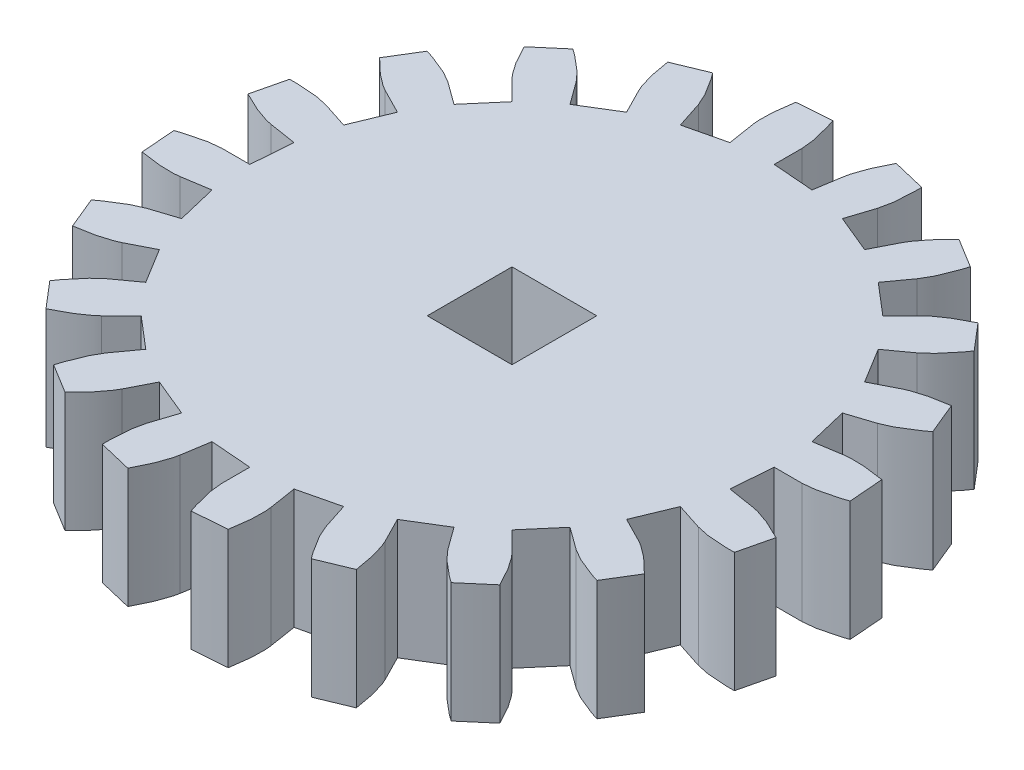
SolidWorks part; units mm, degrees
ref_plane "Front Plane" through (0, 0, 0) normal (0, 0, 1) x (1, 0, 0)
ref_plane "Top Plane" through (0, 0, 0) normal (0, 1, 0) x (1, 0, 0)
ref_plane "Right Plane" through (0, 0, 0) normal (1, 0, 0) x (0, 0, -1)
sketch "Sketch1" plane through (0, 0, 0) normal (0, 1, 0) x (1, 0, 0)
  line L0 (0, 0) -> (0, 2.4204) construction
  line L1 (0, 0) -> (-2.4204, 0) construction
  line L2 (0, 0) -> (-2.7415, -0.2158) construction
  line L3 (0, 0) -> (-2.3906, -0.3786) construction
  line L4 (0, 0) -> (-2.3019, -0.7479) construction
  circle A0 centre (0, 0) radius 2.5 construction
  circle A1 centre (0, 0) radius 2.4204 construction
  circle A2 centre (0, 0) radius 2.1875 construction
  circle A3 centre (0, 0) radius 2.75 construction
  spline S0 degree 4 poles (-2.4204, 0) (-2.4292, 0) (-2.454, -0.0009) (-2.5006, -0.0062) (-2.5759, -0.0199) (-2.6705, -0.0447) (-2.7905, -0.0851) (-2.9283, -0.143) (-3.0753, -0.2174) (-3.2297, -0.3094) (-3.3783, -0.4109) (-3.5209, -0.5204) (-3.6576, -0.6373) (-3.8165, -0.7868) (-3.9972, -0.9784) (-4.193, -1.2163) (-4.3961, -1.5059) (-4.5811, -1.8139) (-4.7448, -2.1352) (-4.8878, -2.4639) (-5.0106, -2.8045) (-5.1135, -3.145) (-5.1975, -3.5021) (-5.254, -3.7998) (-5.292, -4.0848) (-5.3195, -4.3232) (-5.34, -4.636) (-5.3474, -4.8365) (-5.3483, -5.1432) (-5.3425, -5.2576) (-5.3397, -5.3468) knots 0 0 0 0 0 0.005377 0.015084 0.028532 0.04661 0.064855 0.092111 0.119476 0.146842 0.174209 0.201575 0.228941 0.256307 0.307035 0.361767 0.4165 0.471232 0.525964 0.580697 0.635429 0.690161 0.744894 0.799626 0.826992 0.854358 0.909091 0.954545 1 1 1 1 1 construction
  spline S1 degree 4 poles (-2.4204, 0) (-2.4292, 0) (-2.454, -0.0009) (-2.5006, -0.0062) (-2.5759, -0.0199) (-2.6705, -0.0447) (-2.7905, -0.0851) (-2.9283, -0.143) (-3.0753, -0.2174) (-3.2297, -0.3094) (-3.3783, -0.4109) (-3.5209, -0.5204) (-3.6576, -0.6373) (-3.8165, -0.7868) (-3.9972, -0.9784) (-4.193, -1.2163) (-4.3961, -1.5059) (-4.5811, -1.8139) (-4.7448, -2.1352) (-4.8878, -2.4639) (-5.0106, -2.8045) (-5.1135, -3.145) (-5.1975, -3.5021) (-5.254, -3.7998) (-5.292, -4.0848) (-5.3195, -4.3232) (-5.334, -4.5442) (-5.3401, -4.6645) (-5.3428, -4.7462) knots 0 0 0 0 0 0.005377 0.015084 0.028532 0.04661 0.064855 0.092111 0.119476 0.146842 0.174209 0.201575 0.228941 0.256307 0.307035 0.361767 0.4165 0.471232 0.525964 0.580697 0.635429 0.690161 0.744894 0.799626 0.826992 0.854358 0.909091 0.909091 0.909091 0.909091 0.909091
  dimension "D1" = 5.5
  dimension "D2" = 5
  dimension "D3" = 4.8407
  dimension "D4" = 4.375
  dimension "D5" = 2.4204
  dimension "D6" = 4.5
  dimension "D7" = 9
  dimension "D8" = 18
sketch "Sketch2" plane through (0, 0, 0) normal (0, 1, 0) x (1, 0, 0)
  line L0 (0, 0) -> (-2.7415, -0.2158) construction
  line L1 (0, 0) -> (-2.7415, -0.2158) construction
  line L2 (0, 0) -> (-2.3906, -0.3786) construction
  line L3 (0, 0) -> (-2.4204, 0) construction
  line L4 (0, 0) -> (-2.3019, -0.7479) construction
  line L5 (0, 0) -> (-2.3906, -0.3786) construction
  line L6 (0, 0) -> (-2.4204, 0) construction
  line L7 (0, 0) -> (-2.3019, -0.7479) construction
  line L8 (-2.3906, -0.3786) -> (-2.1606, -0.3422)
  line L9 (-2.1606, -0.3422) -> (-2.0804, -0.676)
  line L10 (-2.0804, -0.676) -> (-2.3019, -0.7479) construction
  line L11 (-2.0804, -0.676) -> (-0.4755, -0.1545)
  line L12 (-2.4204, 0) -> (-0.5, 0)
  circle A0 centre (0, 0) radius 2.1875 construction
  circle A1 centre (0, 0) radius 2.4204 construction
  circle A2 centre (0, 0) radius 2.5 construction
  circle A3 centre (0, 0) radius 2.75 construction
  circle A4 centre (0, 0) radius 2.1875 construction
  circle A5 centre (0, 0) radius 2.4204 construction
  circle A6 centre (0, 0) radius 2.5 construction
  circle A7 centre (0, 0) radius 2.75 construction
  arc A8 (-2.7265, -0.3589) -> (-2.7491, -0.0721) centre (0, 0) cw
  circle A11 centre (0, 0) radius 0.5 construction
  arc A12 (-0.5, 0) -> (-0.4755, -0.1545) centre (0, 0) ccw
  spline S0 degree 4 poles (-33.0679, -999.4945) (-0.9019, -19.3405) (-1.14, -0.3967) (-1.8935, 0.1042) (-2.5759, -0.0199) (-2.6705, -0.0447) (-2.7905, -0.0851) (-2.9283, -0.143) (-3.0753, -0.2174) (-3.2297, -0.3094) (-3.3783, -0.4109) (-3.5209, -0.5204) (-3.6576, -0.6373) (-3.8165, -0.7868) (-3.9972, -0.9784) (-4.193, -1.2163) (-4.3961, -1.5059) (-4.5811, -1.8139) (-4.7448, -2.1352) (-4.8878, -2.4639) (-5.0106, -2.8045) (-5.1135, -3.145) (-5.1975, -3.5021) (-5.254, -3.7998) (-5.292, -4.0848) (-5.4268, -5.2538) (-5.3728, -9.2591) (-3.3786, 39.0614) (-37.5486, -1004.1885) knots -0.375533 -0.375533 -0.375533 -0.375533 -0.375533 0.005377 0.015084 0.028532 0.04661 0.064855 0.092111 0.119476 0.146842 0.174209 0.201575 0.228941 0.256307 0.307035 0.361767 0.4165 0.471232 0.525964 0.580697 0.635429 0.690161 0.744894 0.799626 0.826992 0.854358 1.549923 1.549923 1.549923 1.549923 1.549923 only from (-2.4204, 0) to (-5.3428, -4.7462) construction
  spline S1 degree 4 poles (-2.4204, 0) (-2.4292, 0) (-2.454, -0.0009) (-2.5006, -0.0062) (-2.5759, -0.0199) (-2.6492, -0.0391) (-2.7061, -0.0571) (-2.7416, -0.0694) (-2.7491, -0.0721) knots 0 0 0 0 0 0.005377 0.015084 0.028532 0.04661 0.051422 0.051422 0.051422 0.051422 0.051422
  spline S2 degree 4 poles (-2.3906, -0.3786) (-2.3993, -0.38) (-2.4239, -0.383) (-2.4708, -0.385) (-2.5473, -0.3833) (-2.6227, -0.3758) (-2.6817, -0.3669) (-2.7187, -0.3603) (-2.7265, -0.3589) knots 0 0 0 0 0 0.005377 0.015084 0.028532 0.04661 0.051422 0.051422 0.051422 0.051422 0.051422
  point P21 (-2.1606, -0.3422)
  point P24 (-2.0804, -0.676)
  dimension "D2" = 1
extrude "Boss-Extrude1" add sketch "Sketch2" along normal blind 1
pattern_circular "CirPattern1" count 20 over 360 of "Boss-Extrude1"
sketch "Sketch3" plane through (0, 1, 0) normal (0, 1, 0) x (1, 0, 0)
  line L1 (-0.3536, -0.3536) -> (0.3536, -0.3536)
  line L2 (-0.3536, -0.3536) -> (-0.3536, 0.3536)
  line L3 (-0.3536, 0.3536) -> (0.3536, 0.3536)
  line L4 (0.3536, -0.3536) -> (0.3536, 0.3536)
  line L5 (-0.3536, -0.3536) -> (0.3536, 0.3536) construction
  line L6 (-0.3536, 0.3536) -> (0.3536, -0.3536) construction
  circle A0 centre (0, 0) radius 0.5 construction
  circle A1 centre (0, 0) radius 0.5
  point P0 (0, 0)
extrude "Boss-Extrude2" add sketch "Sketch3" against normal blind 1 contours L2 A1 | L3 A1 | L4 A1 | L1 A1
equation "\"Module\"= .25"
equation "\"Number of Teeth\"= 20"
equation "\"Pressure Angle\"= 14.5deg"
equation "\"Pitch Diameter\"= \"Number of Teeth\" * \"Module\""
equation "\"Circular Pitch\"= pi * \"Module\""
equation "\"Addendum\"= \"Module\""
equation "\"Dedendum\"= 1.25 * \"Module\""
equation "\"Base Diameter\"= \"Pitch Diameter\" * cos ( \"Pressure Angle\" )"
equation "\"Base Radius\"= \"Base Diameter\" / 2"
equation "\"Width\"= 1"
equation "\"Outside Diameter\"= \"Pitch Diameter\" + 2 * \"Addendum\""
equation "\"D1@Sketch1\"=\"Outside Diameter\""
equation "\"D3@Sketch1\"=\"Base Diameter\""
equation "\"Root Diameter\"= \"Pitch Diameter\" - 2 * \"Dedendum\""
equation "\"D4@Sketch1\"=\"Root Diameter\""
equation "\"Tooth Angle\"= 360 / \"Number of Teeth\""
equation "\"D6@Sketch1\"=\"Tooth Angle\"/4"
equation "\"D7@Sketch1\"=\"Tooth Angle\"/2"
equation "\"D8@Sketch1\"=\"Tooth Angle\""
equation "\"D2@Sketch1\" = \"Pitch Diameter\""
equation "\"Shaft Diameter\"= 1"
equation "\"D1@CirPattern1\" = \"Number of Teeth\""
equation "\"D2@Sketch2\"= \"Shaft Diameter\""
equation "\"D1@Boss-Extrude1\" = \"Width\""
